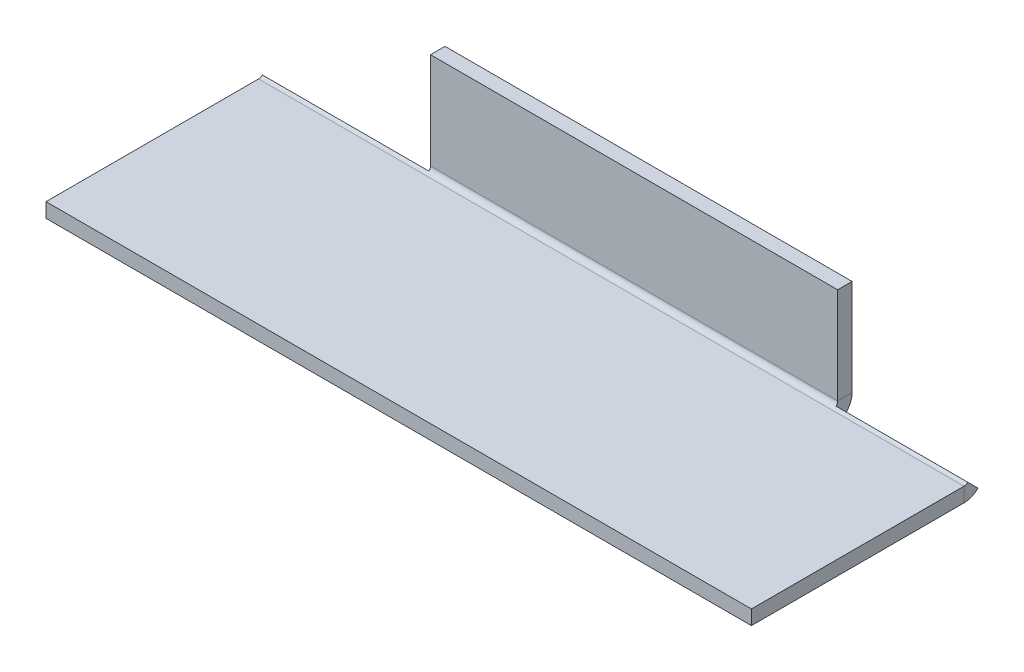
SolidWorks part; units mm, degrees
ref_plane "Ebene vorne" through (0, 0, 0) normal (0, 0, 1) x (1, 0, 0)
ref_plane "Ebene oben" through (0, 0, 0) normal (0, 1, 0) x (1, 0, 0)
ref_plane "Ebene rechts" through (0, 0, 0) normal (1, 0, 0) x (0, 0, -1)
sketch "Skizze1" plane through (0, 0, 0) normal (0, 0, 1) x (1, 0, 0)
  line L0 (-55.4246, 0) -> (-55.4246, 30.7278)
  line L1 (-55.4246, 30.7278) -> (-32.4077, 30.7278)
  line L2 (-32.4077, 30.7278) -> (-32.4077, 45.3918)
  line L3 (-32.4077, 45.3918) -> (23.8352, 45.3918)
  line L4 (23.8352, 45.3918) -> (23.8352, 30.7278)
  line L5 (23.8352, 30.7278) -> (42.026, 30.7278)
  line L6 (42.026, 30.7278) -> (42.026, 0)
  line L7 (42.026, 0) -> (-55.4246, 0)
sheet metal parameters "Blech1" thickness 2 parameters "D1"=0.7366, "Dicke"=2
base flange "Basis-Blech1" sketch "Skizze1" thickness 2 reverse thickness direction no parameters "D1"=0.7366
sketch "Skizze7" plane through (0, 0, 0) normal (0, 0, 1) x (1, 0, 0)
  line L0 (23.8352, 30.7278) -> (-32.4077, 30.7278)
sketched bend "Skizzierte Biegung1"
bend "Skizzenbiegung1" bend radius 0.7366 bend angle 90 parameters "D5"=1
flat pattern "Abwicklung1"
sketch "Biegung-Linien1" plane through (0, 0, 0) normal (0, 0, 1) x (1, 0, 0)
  line L0 (-55.4246, 30.7278) -> (42.026, 30.7278) construction
  line L1 (-55.4246, 30.7278) -> (42.026, 30.7278) construction
  point P0 (23.8352, 46.0191)
  point P1 (-32.4077, 46.0191)
bend of the flat pattern "Abwickeln-<Skizzenbiegung1>1"
